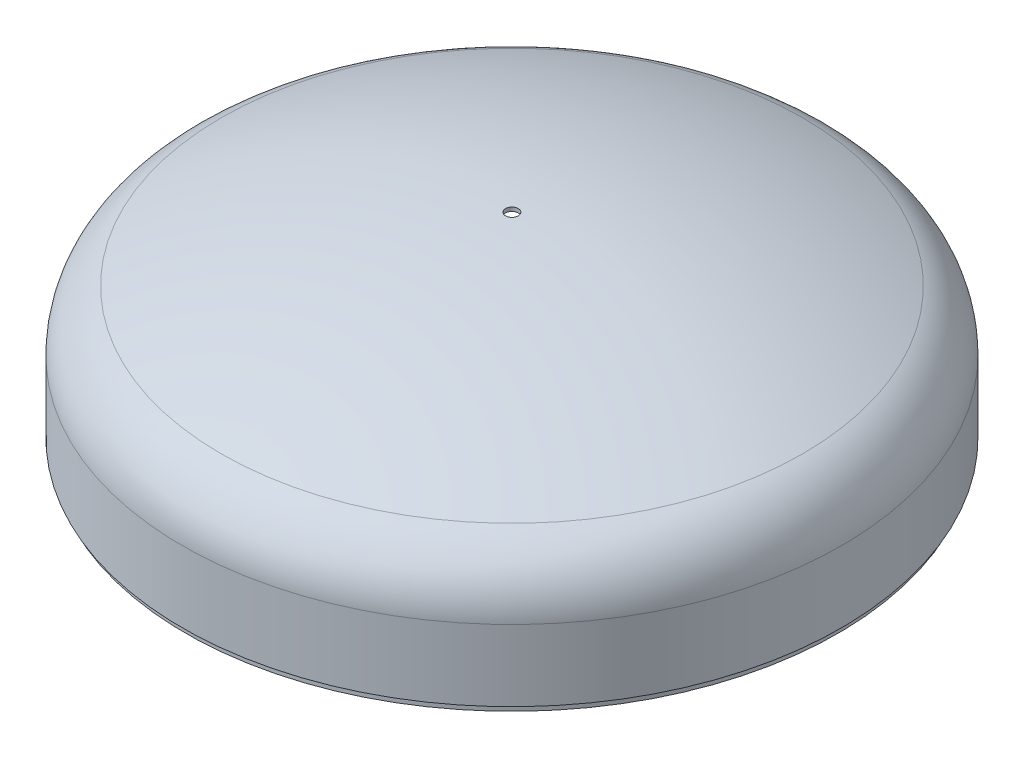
SolidWorks part; units mm, degrees
ref_plane "Plan1" through (0, 0, 0) normal (0, 0, 1) x (1, 0, 0)
ref_plane "Plan2" through (0, 0, 0) normal (0, 1, 0) x (1, 0, 0)
ref_plane "Plan3" through (0, 0, 0) normal (1, 0, 0) x (0, 0, -1)
sketch "Esquisse1" plane through (0, 0, 0) normal (0, 0, 1) x (1, 0, 0)
  line L0 (0, 0) -> (0, 1920) construction
  line L1 (0, 0) -> (620, 0) construction
  line L2 (515, 899.3681) -> (515, 793.3743)
  line L3 (0, 1100) -> (0, 1094)
  line L4 (521, 791.3743) -> (515.8038, 788.3743)
  line L5 (521, 903.8634) -> (521, 791.3743)
  line L6 (515.8038, 788.3743) -> (515.8038, 781.3743)
  line L7 (515.8038, 781.3743) -> (509.8038, 781.3743)
  line L8 (509.8038, 781.3743) -> (509.8038, 788.6423)
  line L9 (511.3038, 791.2403) -> (515, 793.3743)
  arc A0 (459.8995, 999.2459) -> (0, 1100) centre (0, 0) ccw
  arc A1 (452.8806, 995.859) -> (515, 899.3681) centre (409, 899.3681) cw
  arc A2 (452.8806, 995.859) -> (0, 1094) centre (0, 0) ccw
  arc A3 (459.8995, 999.2459) -> (521, 903.8634) centre (416, 903.8634) cw
  arc A4 (509.8038, 788.6423) -> (511.3038, 791.2403) centre (512.8038, 788.6423) cw
  point P21 (509.8038, 790.3743)
  dimension "D1" = 1100
  dimension "D3" = 106
  dimension "D5" = 1094
  dimension "D7" = 105
  dimension "D13" = 3
  dimension "D2" = 515
  dimension "D4" = 6
  dimension "D6" = 6
  dimension "D8" = 120
  dimension "D9" = 120
  dimension "D10" = 7
  dimension "D11" = 12
  dimension "D12" = 9
revolve "Base-Révolution" add sketch "Esquisse1" angle 360 about L0
ref_plane "Plan4" through (0, 788.3743, 0) normal (0, 1, 0) x (1, 0, 0)
sketch "Esquisse2" plane through (0, 788.3743, 0) normal (0, 1, 0) x (1, 0, 0)
  circle A0 centre (0, 0) radius 10
  dimension "D1" = 20
extrude "Enlèv. mat.-Extru.2" cut sketch "Esquisse2" against normal through all both and the other way through all
